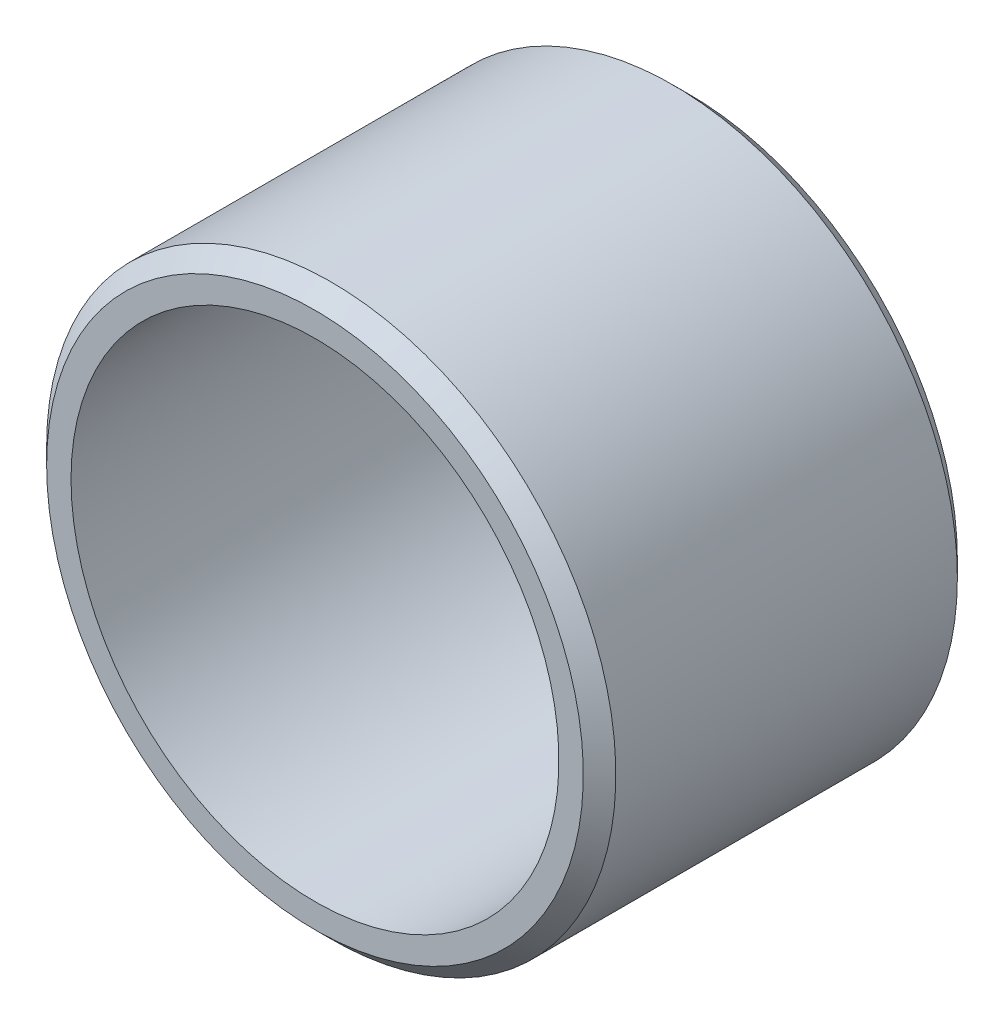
SolidWorks part; units mm, degrees
ref_plane "Face" through (0, 0, 0) normal (0, 0, 1) x (1, 0, 0)
ref_plane "Dessus" through (0, 0, 0) normal (0, 1, 0) x (1, 0, 0)
ref_plane "Droite" through (0, 0, 0) normal (1, 0, 0) x (0, 0, -1)
sketch "Esquisse1" plane through (0, 0, 0) normal (0, 0, 1) x (1, 0, 0)
  circle A0 centre (0, 0) radius 15
  circle A1 centre (0, 0) radius 17.5
  dimension "D1" = 30
  dimension "D2" = 35
extrude "Extrusion1" add sketch "Esquisse1" along normal blind 23
chamfer "Chanfrein1" distance 1 angle 45 2 edges at (17.5, 0, 0) (17.5, 0, 23)
